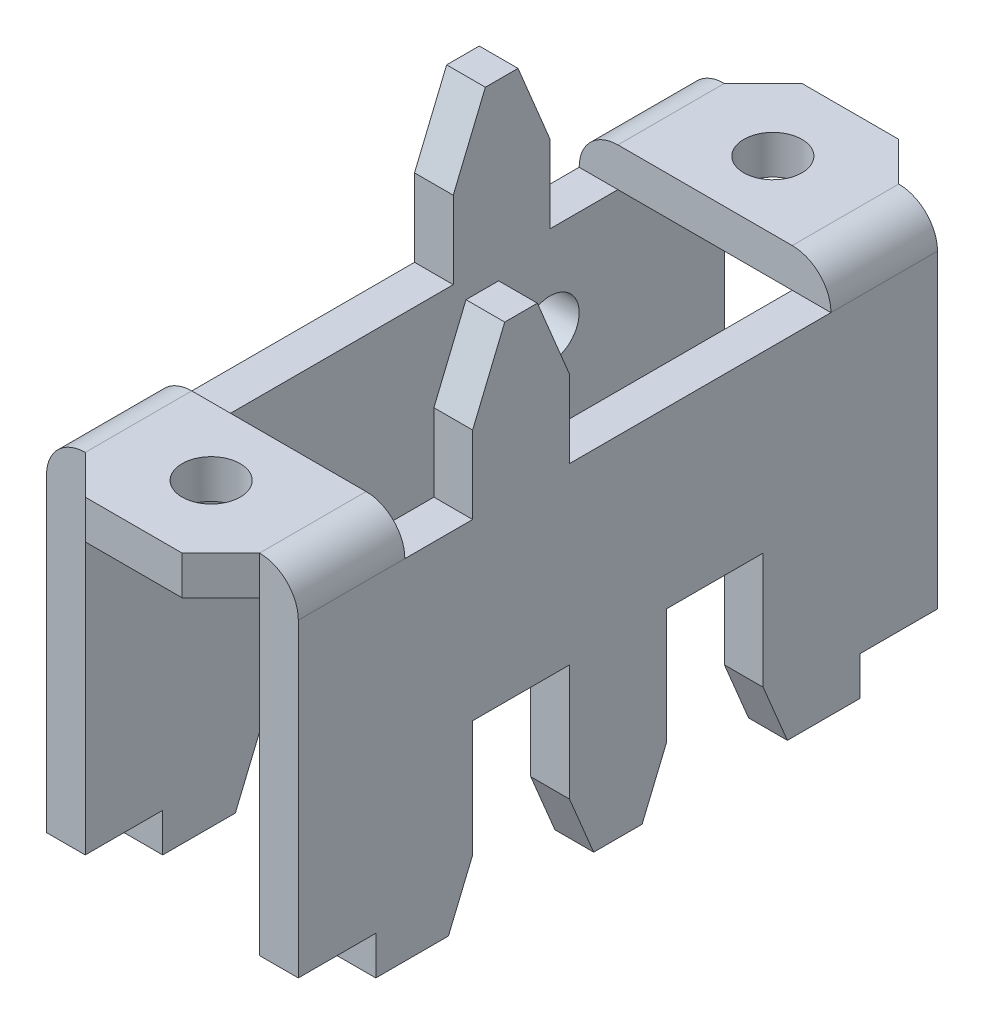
SolidWorks part; units mm, degrees
ref_plane "Plan de face" through (0, 0, 0) normal (0, 0, 1) x (1, 0, 0)
ref_plane "Plan de dessus" through (0, 0, 0) normal (0, 1, 0) x (1, 0, 0)
ref_plane "Plan de droite" through (0, 0, 0) normal (1, 0, 0) x (0, 0, -1)
sketch "Esquisse1" plane through (0, 0, 0) normal (0, 0, 1) x (1, 0, 0)
  line L0 (4.5, -20) -> (6.5, -20)
  line L1 (-4.5, 0) -> (4.5, 0)
  line L2 (-6.5, -2) -> (-6.5, -20)
  line L3 (-6.5, -20) -> (-4.5, -20)
  line L4 (6.5, -2) -> (6.5, -20)
  line L6 (-4.5, -20) -> (-4.5, -2)
  line L7 (-4.5, -2) -> (4.5, -2)
  line L8 (4.5, -20) -> (4.5, -2)
  arc A0 (4.5, 0) -> (6.5, -2) centre (4.5, -2) cw
  arc A1 (-4.5, 0) -> (-6.5, -2) centre (-4.5, -2) ccw
  point P11 (6.5, 0)
  point P14 (-6.5, 0)
  dimension "D6" = 2
  dimension "D1" = 13
  dimension "D2" = 20
  dimension "D3" = 2
  dimension "D4" = 2
  dimension "D5" = 2
extrude "Boss.-Extru.1" add sketch "Esquisse1" along normal mid plane 37
sketch "Esquisse2" plane through (0, 0, 0) normal (0, 1, 0) x (1, 0, 0)
  line L0 (6.5, -18.5) -> (6.5, 18.5) construction
  line L1 (-6.5, -11) -> (6.5, -11)
  line L2 (-6.5, -11) -> (-6.5, 11)
  line L3 (-6.5, 11) -> (6.5, 11)
  line L4 (6.5, -11) -> (6.5, 11)
  line L5 (-6.5, -18.5) -> (-6.5, 18.5) construction
  line L6 (0, 0) -> (6.5, 0) construction
  dimension "D1" = 22
extrude "Enlèv. mat.-Extru.1" cut sketch "Esquisse2" against normal up to surface (2 mm away)
sketch "Esquisse3" plane through (0, 0, 0) normal (0, 1, 0) x (1, 0, 0)
  line L0 (-6.5, 0) -> (6.5, 0) construction
  line L1 (-6.5, -11) -> (-6.5, 11) construction
  line L2 (6.5, 11) -> (6.5, -11) construction
  line L3 (0, 14.5) -> (0, 0) construction
  line L4 (-6.5, 16.5) -> (-4.5, 16.5)
  line L5 (-6.5, 11) -> (-6.5, 18.5) construction
  line L6 (6.5, 11) -> (6.5, 18.5) construction
  line L7 (-4.5, 16.5) -> (-2.5, 18.5)
  line L8 (-4.5, 11) -> (-4.5, 18.5) construction
  line L9 (4.5, 18.5) -> (-4.5, 18.5) construction
  line L10 (2.5, 18.5) -> (-2.5, 18.5)
  line L11 (4.5, 16.5) -> (2.5, 18.5)
  line L12 (4.5, 11) -> (4.5, 18.5) construction
  line L13 (4.5, 16.5) -> (6.5, 16.5)
  line L14 (-6.5, 16.5) -> (-6.5, 19.5)
  line L15 (-6.5, 19.5) -> (6.5, 19.5)
  line L16 (6.5, 19.5) -> (6.5, 16.5)
  line L17 (-6.5, -16.5) -> (-6.5, -19.5)
  line L18 (-6.5, -16.5) -> (-4.5, -16.5)
  line L19 (-4.5, -16.5) -> (-2.5, -18.5)
  line L20 (2.5, -18.5) -> (-2.5, -18.5)
  line L21 (4.5, -16.5) -> (2.5, -18.5)
  line L22 (4.5, -16.5) -> (6.5, -16.5)
  line L23 (6.5, -19.5) -> (6.5, -16.5)
  line L24 (-6.5, -19.5) -> (6.5, -19.5)
  circle A0 centre (0, 14.5) radius 1.5
  circle A1 centre (0, -14.5) radius 1.5
  dimension "D1" = 3
  dimension "D2" = 14.5
  dimension "D3" = 16.5
  dimension "D4" = 5
  dimension "D5" = 1
extrude "Enlèv. mat.-Extru.2" cut sketch "Esquisse3" against normal through all
sketch "Esquisse4" plane through (-6.5, 0, 0) normal (-1, 0, 0) x (0, 0, 1)
  line L0 (16.5, -20) -> (-16.5, -20) construction
  line L1 (1.25, -20) -> (8.75, -20)
  line L2 (7.5, -17) -> (7.5, -11)
  line L3 (7.5, -11) -> (2.5, -11)
  line L4 (2.5, -17) -> (2.5, -11)
  line L5 (0, 0) -> (0, -21.4694) construction
  line L6 (16.5, -20) -> (16.5, -2) construction
  line L7 (12.5, -20) -> (16.5, -20)
  line L8 (12.5, -20) -> (12.5, -18)
  line L9 (12.5, -18) -> (16.5, -18)
  line L10 (16.5, -20) -> (16.5, -18)
  line L11 (7.5, -17) -> (8.75, -20)
  line L13 (2.5, -17) -> (1.25, -20)
  line L14 (5, -11) -> (5, -23.0007) construction
  line L16 (-2.5, -17) -> (-1.25, -20)
  line L17 (-2.5, -17) -> (-2.5, -11)
  line L18 (-7.5, -11) -> (-2.5, -11)
  line L19 (-7.5, -17) -> (-7.5, -11)
  line L22 (-7.5, -17) -> (-8.75, -20)
  line L23 (-1.25, -20) -> (-8.75, -20)
  line L24 (-12.5, -20) -> (-16.5, -20)
  line L25 (-16.5, -20) -> (-16.5, -18)
  line L26 (-12.5, -18) -> (-16.5, -18)
  line L27 (-12.5, -20) -> (-12.5, -18)
  dimension "D1" = 4
  dimension "D2" = 2
  dimension "D3" = 9
  dimension "D4" = 5
  dimension "D5" = 2.5
  dimension "D6" = 1.25
  dimension "D7" = 6
extrude "Enlèv. mat.-Extru.3" cut sketch "Esquisse4" against normal through all
sketch "Esquisse5" plane through (-6.5, 0, 0) normal (-1, 0, 0) x (0, 0, 1)
  line L0 (-7.5, -6.5) -> (7.5, -6.5) construction
  line L1 (0, 0) -> (0, -21.4694) construction
  line L2 (11, -2) -> (-11, -2) construction
  circle A0 centre (-7.5, -6.5) radius 1.5
  circle A1 centre (7.5, -6.5) radius 1.5
  point P6 (0, -6.5)
  dimension "D2" = 3
  dimension "D1" = 15
  dimension "D3" = 4.5
extrude "Enlèv. mat.-Extru.4" cut sketch "Esquisse5" against normal up to next
sketch "Esquisse6" plane through (0, -2, 0) normal (0, 1, 0) x (1, 0, 0)
  line L0 (0, 0) -> (-6.9858, 0) construction
  line L1 (-4.5, -11) -> (-4.5, 11) construction
  line L2 (-4.5, 7.5) -> (-6.5, 7.5)
  line L3 (-4.5, 7.5) -> (-4.5, 2.5)
  line L4 (-4.5, 2.5) -> (-6.5, 2.5)
  line L5 (-6.5, 7.5) -> (-6.5, 2.5)
  line L6 (-6.5, -11) -> (-6.5, 11) construction
  line L7 (6.5, 11) -> (6.5, -11) construction
  line L8 (6.5, -2.5) -> (4.5, -2.5)
  line L9 (6.5, -2.5) -> (6.5, -7.5)
  line L10 (6.5, -7.5) -> (4.5, -7.5)
  line L11 (4.5, -2.5) -> (4.5, -7.5)
  line L12 (4.5, -11) -> (4.5, 11) construction
  dimension "D1" = 5
  dimension "D2" = 15
extrude "Boss.-Extru.2" add sketch "Esquisse6" along normal blind 8
chamfer "Chanfrein1" distance 4 angle 22.5 4 edges at (5.5, 6, 2.5) (5.5, 6, 7.5) (-5.5, 6, -2.5) (-5.5, 6, -7.5)
